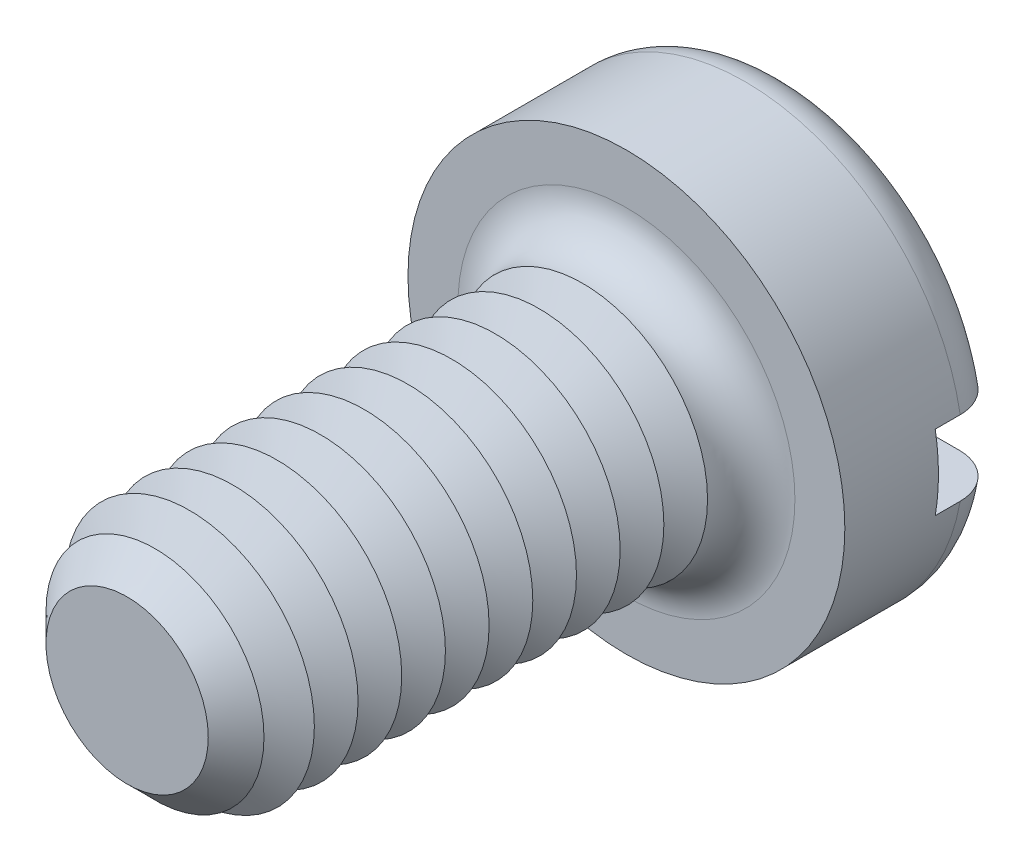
SolidWorks part; units mm, degrees
ref_plane "Front Plane" through (0, 0, 0) normal (0, 0, 1) x (1, 0, 0)
ref_plane "Top Plane" through (0, 0, 0) normal (0, 1, 0) x (1, 0, 0)
ref_plane "Right Plane" through (0, 0, 0) normal (1, 0, 0) x (0, 0, -1)
sketch "Sketch3" plane through (0, 0, 0) normal (0, 0, 1) x (1, 0, 0)
  circle A0 centre (0, 0) radius 3.5
  dimension "D1" = 7
extrude "Boss-Extrude2" add sketch "Sketch3" against normal blind 2.6
sketch "Sketch4" plane through (0, 0, 0) normal (0, 0, 1) x (1, 0, 0)
  circle A0 centre (0, 0) radius 2
  dimension "D1" = 4
extrude "Boss-Extrude3" add sketch "Sketch4" along normal blind 8
fillet "Fillet1" radius 0.7 2 edges at (3.5, 0, -2.6) (2, 0, 0)
chamfer "Chamfer1" distance 0.7 angle 45 1 edges at (2, 0, 8)
sketch "Sketch5" plane through (0, 0, 0) normal (1, 0, 0) x (0, 0, -1)
  line L0 (1.6944, 0) -> (-7.6738, 0) construction
sketch "Sketch6" plane through (0, 0, 0) normal (1, 0, 0) x (0, 0, -1)
  line L0 (-0.7, 2) -> (-1.05, 1.3938)
  line L1 (-1.05, 1.3938) -> (-1.4, 2)
  line L2 (-0.7, 2) -> (-7.3, 2) construction
  line L3 (-1.4, 2) -> (-0.7, 2)
  dimension "D1" = 0.7
revolve "Cut-Revolve1" cut sketch "Sketch6" angle 360 about L0
pattern_linear "LPattern1" count 10 spacing 0.7 along (0, 0, 1) of "Cut-Revolve1"
sketch "Sketch8" plane through (0, 0, -2.6) normal (0, 0, -1) x (-1, 0, 0)
  line L1 (3.5, -0.6) -> (-3.5, -0.6)
  line L2 (3.5, -0.6) -> (3.5, 0.6)
  line L3 (3.5, 0.6) -> (-3.5, 0.6)
  line L4 (-3.5, -0.6) -> (-3.5, 0.6)
  line L5 (3.5, -0.6) -> (-3.5, 0.6) construction
  line L6 (3.5, 0.6) -> (-3.5, -0.6) construction
  point P0 (0, 0)
  dimension "D1" = 7
  dimension "D2" = 1.2
extrude "Cut-Extrude1" cut sketch "Sketch8" against normal blind 1.1
